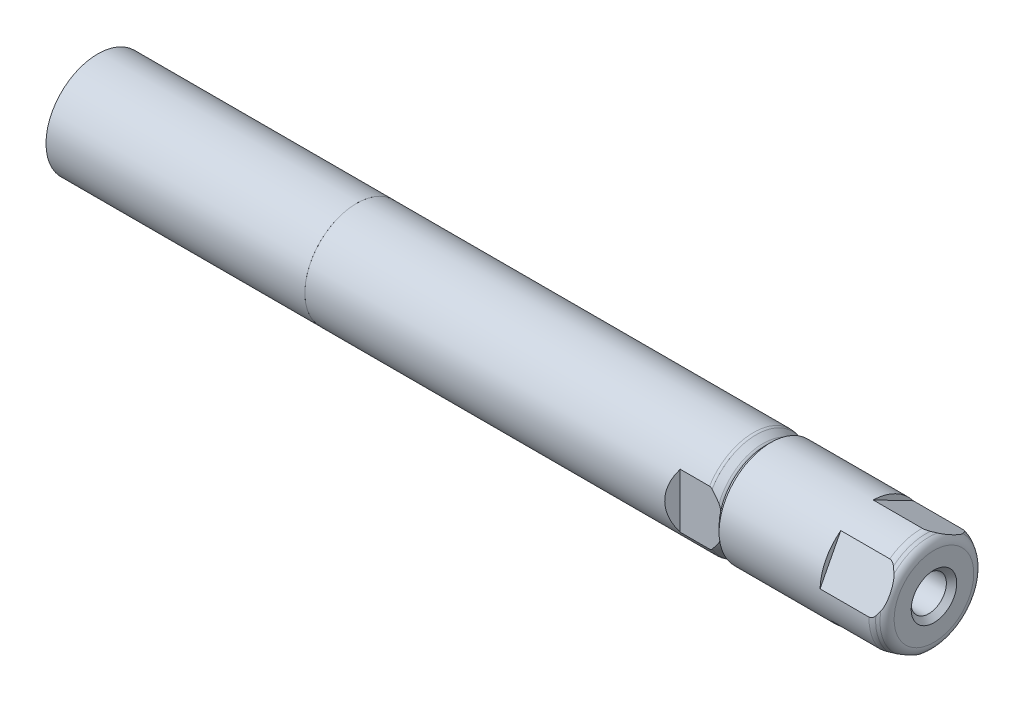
SolidWorks part; units mm, degrees
ref_plane "前视基准面" through (0, 0, 0) normal (0, 0, 1) x (1, 0, 0)
ref_plane "上视基准面" through (0, 0, 0) normal (0, 1, 0) x (1, 0, 0)
ref_plane "右视基准面" through (0, 0, 0) normal (1, 0, 0) x (0, 0, -1)
imported_body "导轴-1-surface1"
imported_body "连接头-1-surface1"
ref_plane "基准面1" through (-203.9011, 0, 0) normal (-1, 0, 0) x (0, 0, 1)
sketch "草图1" plane through (-203.9011, 0, 0) normal (-1, 0, 0) x (0, 0, 1)
  circle A0 centre (0, 8.0832) radius 10
extrude "凸台-拉伸1" add sketch "草图1" along normal blind 50
